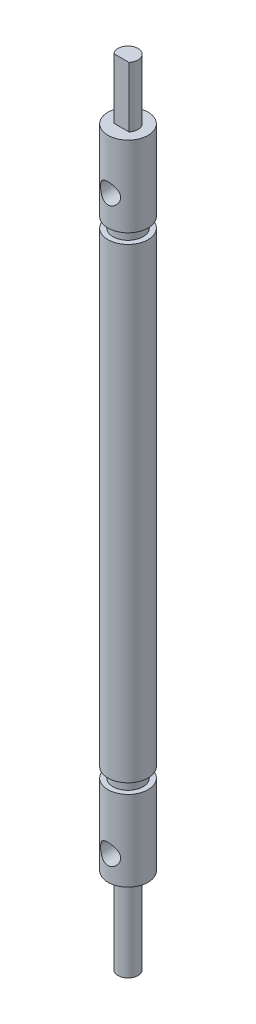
SolidWorks part; units mm, degrees
ref_plane "Front" through (0, 0, 0) normal (0, 0, 1) x (1, 0, 0)
ref_plane "Top" through (0, 0, 0) normal (0, 1, 0) x (1, 0, 0)
ref_plane "Right" through (0, 0, 0) normal (1, 0, 0) x (0, 0, -1)
sketch "Sketch1" plane through (0, 0, 0) normal (0, 0, 1) x (1, 0, 0)
  line L0 (0, 0) -> (0, 79)
  line L1 (0, 79) -> (1, 79)
  line L2 (1, 79) -> (1, 73)
  line L3 (1, 73) -> (2, 73)
  line L4 (2, 73) -> (2, 65)
  line L5 (2, 65) -> (1.5, 65)
  line L6 (1.5, 65) -> (1.5, 64)
  line L7 (1.5, 64) -> (2, 64)
  line L8 (2, 64) -> (2, 17.5445)
  line L9 (2, 17.5445) -> (1.5, 17.5445)
  line L10 (1.5, 17.5445) -> (1.5, 16.5445)
  line L11 (1.5, 16.5445) -> (2, 16.5445)
  line L12 (2, 16.5445) -> (2, 8.5445)
  line L13 (2, 8.5445) -> (1, 8.5445)
  line L14 (1, 8.5445) -> (1, 0)
  line L15 (1, 0) -> (0, 0)
  dimension "D1" = 1
  dimension "D2" = 6
  dimension "D3" = 1
  dimension "D4" = 8
  dimension "D5" = 0.5
  dimension "D6" = 1
  dimension "D7" = 0.5
  dimension "D8" = 79
  dimension "D9" = 1
  dimension "D10" = 1
  dimension "D11" = 8
  dimension "D12" = 1
  dimension "D13" = 0.5
revolve "Revolve1" add sketch "Sketch1" angle 360 about L0
sketch "Sketch4" plane through (0, 0, 0) normal (0, 0, 1) x (1, 0, 0)
  line L0 (1, 79) -> (-1, 79) construction
  line L1 (-1, 0) -> (1, 0) construction
  line L3 (2, 65) -> (2, 73) construction
  circle A0 centre (0, 11) radius 1
  circle A1 centre (0, 68) radius 1
  dimension "D2" = 2
  dimension "D3" = 57
  dimension "D4" = 2
  dimension "D5" = 11
  dimension "D1" = 11
  dimension "D6" = 2
extrude "Cut-Extrude3" cut sketch "Sketch4" against normal through all and the other way through all
sketch "Sketch5" plane through (0, 79, 0) normal (0, 1, 0) x (-1, 0, 0)
  line L0 (0.75, 0.6614) -> (-0.75, 0.6614)
  arc A0 (0.75, 0.6614) -> (-0.75, 0.6614) centre (0, 0) ccw
extrude "Cut-Extrude5" cut sketch "Sketch5" against normal blind 6
